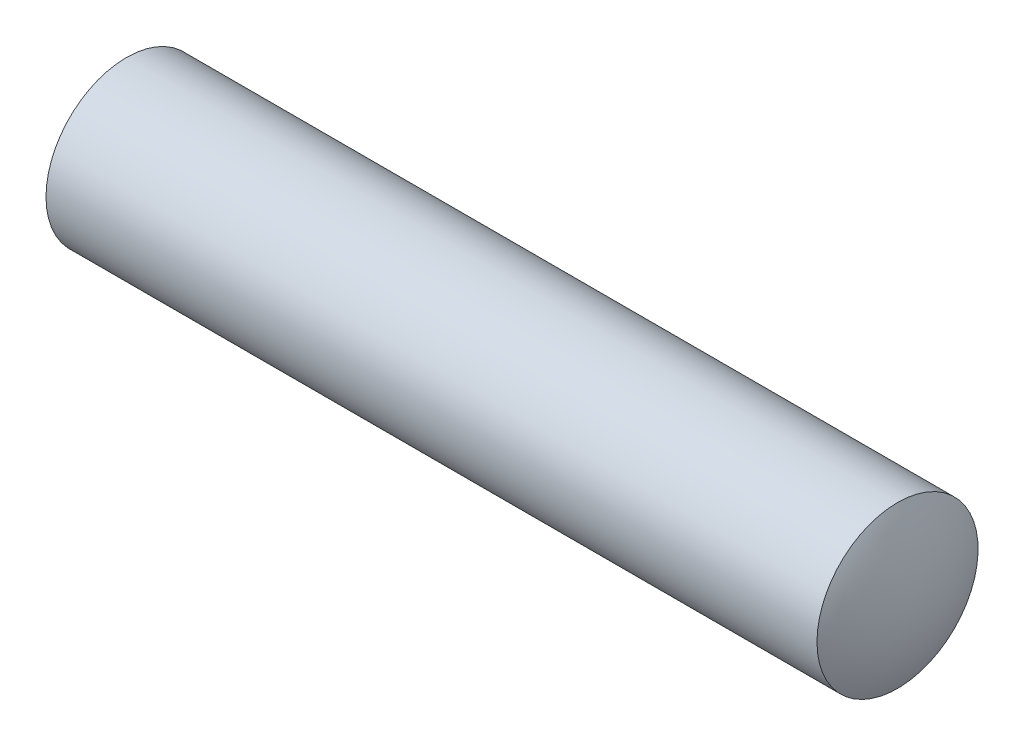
SolidWorks part; units mm, degrees
ref_plane "Face" through (0, 0, 0) normal (0, 0, 1) x (1, 0, 0)
ref_plane "Dessus" through (0, 0, 0) normal (0, 1, 0) x (1, 0, 0)
ref_plane "Droite" through (0, 0, 0) normal (1, 0, 0) x (0, 0, -1)
sketch "Esquisse1" plane through (0, 0, 0) normal (0, 0, 1) x (1, 0, 0)
  line L0 (-10, 0) -> (10, 0) construction
  line L1 (9.5, 1.985) -> (-9.5, 1.985)
  line L2 (-10, 0) -> (10, 0)
  arc A1 (10, 0) -> (9.5, 1.985) centre (5.8098, 0) ccw
  arc A2 (-9.5, 1.985) -> (-10, 0) centre (-5.8098, 0) ccw
  dimension "D1" = 20
  dimension "D2" = 3.97
  dimension "D3" = 0.5
  dimension "D4" = 0.5
revolve "Base-Révolution" add sketch "Esquisse1" angle 360 about L0
